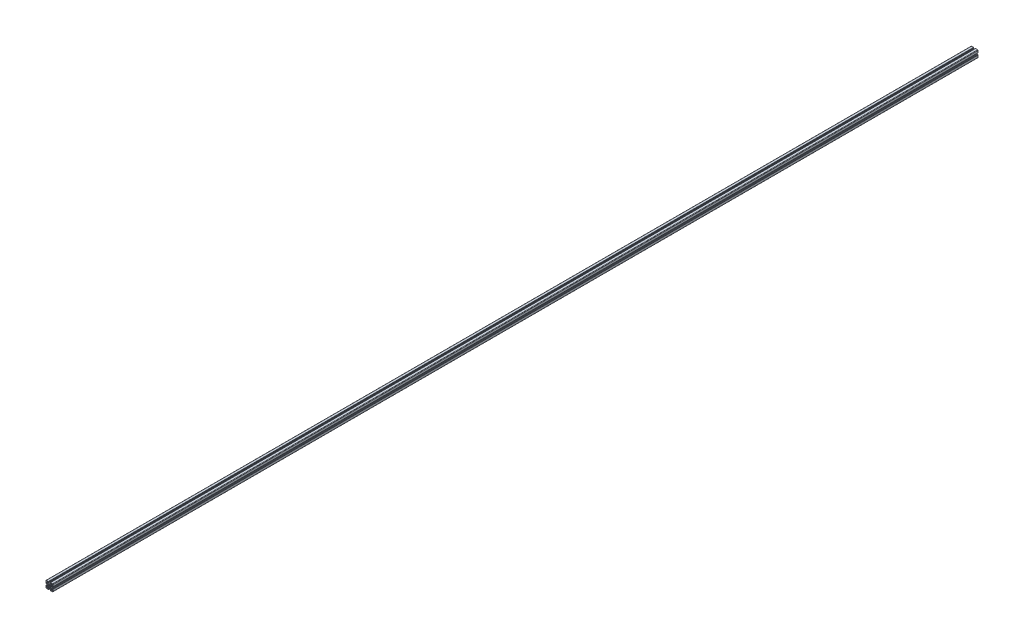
SolidWorks part; units mm, degrees
ref_plane "Front Plane" through (0, 0, 0) normal (0, 0, 1) x (1, 0, 0)
ref_plane "Top Plane" through (0, 0, 0) normal (0, 1, 0) x (1, 0, 0)
ref_plane "Right Plane" through (0, 0, 0) normal (1, 0, 0) x (0, 0, -1)
sketch "Sketch1" plane through (0, 0, 0) normal (0, 0, 1) x (1, 0, 0)
  line L0 (10.55, 18) -> (9, 18)
  line L1 (18.5, 21) -> (9, 21)
  line L2 (21, 9.0002) -> (21, 18.5)
  line L3 (18, 9.0002) -> (18, 10.55)
  line L4 (17, 11.55) -> (12.55, 11.55)
  line L5 (11.55, 12.55) -> (11.55, 17)
  line L6 (7.974, 0.7926) -> (7.5401, 0.0468)
  line L7 (-0.8674, 4.9242) -> (-0.9675, 5.4811)
  line L8 (-3.1913, 4.5626) -> (-2.864, 4.0985)
  line L9 (-4.0897, 2.8765) -> (-4.5668, 3.2082)
  line L10 (-5.4897, 0.9862) -> (-4.9205, 0.8878)
  line L11 (11.1298, 9.425) -> (7.5635, 5.8587)
  line L12 (16.3169, 9.9945) -> (12.5048, 9.9945)
  line L13 (16.5169, 5.2) -> (16.5169, 9.7945)
  line L14 (20.7196, 5) -> (16.7169, 5)
  line L15 (21.0196, 5.3) -> (21.0196, 5.5)
  line L16 (22, 5.8) -> (21.3196, 5.8)
  line L17 (22.5, 6.3) -> (22.5, 19.5)
  line L18 (19.5, 22.5) -> (6.3757, 22.5)
  line L19 (5.8757, 21.3) -> (5.8757, 22)
  line L20 (5.5757, 21) -> (5.3, 21)
  line L21 (5, 16.6668) -> (5, 20.7)
  line L22 (9.9054, 16.4668) -> (5.2, 16.4668)
  line L23 (10.1054, 12.4716) -> (10.1054, 16.2668)
  line L24 (5.9449, 7.4827) -> (9.5196, 11.0574)
  line L25 (0.1126, 7.6069) -> (0.7547, 7.9748)
  line L26 (5.4897, 0.9862) -> (4.9205, 0.8878)
  line L27 (4.0897, 2.8765) -> (4.5668, 3.2082)
  line L28 (3.1913, 4.5626) -> (2.864, 4.0985)
  line L29 (0.8674, 4.9242) -> (0.9675, 5.4811)
  line L30 (-10.55, -18) -> (-9, -18)
  line L31 (-18.5, -21) -> (-9, -21)
  line L32 (-21, -9.0002) -> (-21, -18.5)
  line L33 (-18, -9.0002) -> (-18, -10.55)
  line L34 (-17, -11.55) -> (-12.55, -11.55)
  line L35 (-11.55, -12.55) -> (-11.55, -17)
  line L36 (-7.974, -0.7926) -> (-7.5401, -0.0468)
  line L37 (-11.1298, -9.425) -> (-7.5635, -5.8587)
  line L38 (-16.3169, -9.9945) -> (-12.5048, -9.9945)
  line L39 (-16.5169, -5.2) -> (-16.5169, -9.7945)
  line L40 (-20.7196, -5) -> (-16.7169, -5)
  line L41 (-21.0196, -5.3) -> (-21.0196, -5.5)
  line L42 (-22, -5.8) -> (-21.3196, -5.8)
  line L43 (-22.5, -6.3) -> (-22.5, -19.5)
  line L44 (-19.5, -22.5) -> (-6.3757, -22.5)
  line L45 (-5.8757, -21.3) -> (-5.8757, -22)
  line L46 (-5.5757, -21) -> (-5.3, -21)
  line L47 (-5, -16.6668) -> (-5, -20.7)
  line L48 (-9.9054, -16.4668) -> (-5.2, -16.4668)
  line L49 (-10.1054, -12.4716) -> (-10.1054, -16.2668)
  line L50 (-5.9449, -7.4827) -> (-9.5196, -11.0574)
  line L51 (-0.1126, -7.6069) -> (-0.7547, -7.9748)
  line L52 (0.8674, -4.9242) -> (0.9675, -5.4811)
  line L53 (3.1913, -4.5626) -> (2.864, -4.0985)
  line L54 (4.0897, -2.8765) -> (4.5668, -3.2082)
  line L55 (5.4897, -0.9862) -> (4.9205, -0.8878)
  line L56 (0.1126, -7.6069) -> (0.7547, -7.9748)
  line L57 (5.9449, -7.4827) -> (9.5196, -11.0574)
  line L58 (10.1054, -12.4716) -> (10.1054, -16.2668)
  line L59 (9.9054, -16.4668) -> (5.2, -16.4668)
  line L60 (5, -16.6668) -> (5, -20.7)
  line L61 (5.5757, -21) -> (5.3, -21)
  line L62 (-0.1126, 7.6069) -> (-0.7547, 7.9748)
  line L63 (-5.9449, 7.4827) -> (-9.5196, 11.0574)
  line L64 (-10.1054, 12.4716) -> (-10.1054, 16.2668)
  line L65 (-9.9054, 16.4668) -> (-5.2, 16.4668)
  line L66 (-5, 16.6668) -> (-5, 20.7)
  line L67 (-5.5757, 21) -> (-5.3, 21)
  line L68 (-5.8757, 21.3) -> (-5.8757, 22)
  line L69 (-19.5, 22.5) -> (-6.3757, 22.5)
  line L70 (-22.5, 6.3) -> (-22.5, 19.5)
  line L71 (-22, 5.8) -> (-21.3196, 5.8)
  line L72 (-21.0196, 5.3) -> (-21.0196, 5.5)
  line L73 (-20.7196, 5) -> (-16.7169, 5)
  line L74 (-16.5169, 5.2) -> (-16.5169, 9.7945)
  line L75 (-16.3169, 9.9945) -> (-12.5048, 9.9945)
  line L76 (-11.1298, 9.425) -> (-7.5635, 5.8587)
  line L77 (-7.974, 0.7926) -> (-7.5401, 0.0468)
  line L78 (5.8757, -21.3) -> (5.8757, -22)
  line L79 (19.5, -22.5) -> (6.3757, -22.5)
  line L80 (22.5, -6.3) -> (22.5, -19.5)
  line L81 (22, -5.8) -> (21.3196, -5.8)
  line L82 (21.0196, -5.3) -> (21.0196, -5.5)
  line L83 (20.7196, -5) -> (16.7169, -5)
  line L84 (16.5169, -5.2) -> (16.5169, -9.7945)
  line L85 (16.3169, -9.9945) -> (12.5048, -9.9945)
  line L86 (11.1298, -9.425) -> (7.5635, -5.8587)
  line L87 (-5.4897, -0.9862) -> (-4.9205, -0.8878)
  line L88 (-4.0897, -2.8765) -> (-4.5668, -3.2082)
  line L89 (-3.1913, -4.5626) -> (-2.864, -4.0985)
  line L90 (-0.8674, -4.9242) -> (-0.9675, -5.4811)
  line L91 (7.974, -0.7926) -> (7.5401, -0.0468)
  line L92 (-11.55, 12.55) -> (-11.55, 17)
  line L93 (-17, 11.55) -> (-12.55, 11.55)
  line L94 (-18, 9.0002) -> (-18, 10.55)
  line L95 (-21, 9.0002) -> (-21, 18.5)
  line L96 (-18.5, 21) -> (-9, 21)
  line L97 (-10.55, 18) -> (-9, 18)
  line L98 (11.55, -12.55) -> (11.55, -17)
  line L99 (17, -11.55) -> (12.55, -11.55)
  line L100 (18, -9.0002) -> (18, -10.55)
  line L101 (21, -9.0002) -> (21, -18.5)
  line L102 (18.5, -21) -> (9, -21)
  line L103 (10.55, -18) -> (9, -18)
  line L104 (-33.3633, 0) -> (37.7265, 0) construction
  line L105 (0, 32.2957) -> (0, -36.0465) construction
  arc A0 (9, 18) -> (9, 21) centre (9, 19.5) cw
  arc A1 (18.5, 21) -> (21, 18.5) centre (18.5, 18.5) cw
  arc A2 (21, 9.0002) -> (18, 9.0002) centre (19.5, 9.0002) cw
  arc A3 (17, 11.55) -> (18, 10.55) centre (17, 10.55) cw
  arc A4 (12.55, 11.55) -> (11.55, 12.55) centre (12.55, 12.55) cw
  arc A5 (10.55, 18) -> (11.55, 17) centre (10.55, 17) cw
  arc A6 (7.5313, 0) -> (7.5401, 0.0468) centre (7.7309, -0.013) cw
  arc A7 (8, 0.9141) -> (7.974, 0.7926) centre (7.8011, 0.8932) cw
  arc A8 (7.2004, 3.6119) -> (8, 0.9141) centre (0.0496, 0.0249) cw
  arc A9 (7.2004, 3.6119) -> (7.5635, 5.8587) centre (8.9385, 4.4837) cw
  arc A10 (11.1298, 9.425) -> (12.5048, 9.9945) centre (12.5048, 8.05) cw
  arc A11 (16.3169, 9.9945) -> (16.5169, 9.7945) centre (16.3169, 9.7945) cw
  arc A12 (16.7169, 5) -> (16.5169, 5.2) centre (16.7169, 5.2) cw
  arc A13 (21.0196, 5.3) -> (20.7196, 5) centre (20.7196, 5.3) cw
  arc A14 (0.8674, 4.9242) -> (-0.8674, 4.9242) centre (0, 0) ccw
  arc A15 (-0.9675, 5.4811) -> (-1.5951, 5.8941) centre (-1.4627, 5.4119) ccw
  arc A16 (-1.5951, 5.8941) -> (-3.0444, 5.2994) centre (-0.0235, 0) ccw
  arc A17 (-3.0444, 5.2994) -> (-3.1913, 4.5626) centre (-2.7943, 4.8665) ccw
  arc A18 (-2.864, 4.0985) -> (-4.0897, 2.8765) centre (0, 0) ccw
  arc A19 (-4.5668, 3.2082) -> (-5.3025, 3.0565) centre (-4.868, 2.8091) ccw
  arc A20 (-5.3025, 3.0565) -> (-5.9068, 1.6112) centre (-0.0235, 0) ccw
  arc A21 (-5.9068, 1.6112) -> (-5.4897, 0.9862) centre (-5.4239, 1.4819) ccw
  arc A22 (-4.9205, 0.8878) -> (-5, 0) centre (0, 0) ccw
  arc A23 (21.0196, 5.5) -> (21.3196, 5.8) centre (21.3196, 5.5) cw
  arc A24 (22.5, 6.3) -> (22, 5.8) centre (22, 6.3) cw
  arc A25 (19.5, 22.5) -> (22.5, 19.5) centre (19.5, 19.5) cw
  arc A26 (5.8757, 22) -> (6.3757, 22.5) centre (6.3757, 22) cw
  arc A27 (5.8757, 21.3) -> (5.5757, 21) centre (5.5757, 21.3) cw
  arc A28 (5, 20.7) -> (5.3, 21) centre (5.3, 20.7) cw
  arc A29 (5.2, 16.4668) -> (5, 16.6668) centre (5.2, 16.6668) cw
  arc A30 (9.9054, 16.4668) -> (10.1054, 16.2668) centre (9.9054, 16.2668) cw
  arc A31 (10.1054, 12.4716) -> (9.5196, 11.0574) centre (8.1054, 12.4716) cw
  arc A32 (5.9449, 7.4827) -> (3.6665, 7.1733) centre (4.5855, 8.9496) cw
  arc A33 (0.8764, 8) -> (3.6665, 7.1733) centre (0.0235, 0) cw
  arc A34 (0.7547, 7.9748) -> (0.8764, 8) centre (0.8542, 7.8013) cw
  arc A35 (0.1126, 7.6069) -> (0, 7.531) centre (-0.0489, 7.7249) cw
  arc A36 (4.9205, 0.8878) -> (5, 0) centre (0, 0) cw
  arc A37 (5.9068, 1.6112) -> (5.4897, 0.9862) centre (5.4239, 1.4819) cw
  arc A38 (5.3025, 3.0565) -> (5.9068, 1.6112) centre (0.0235, 0) cw
  arc A39 (4.5668, 3.2082) -> (5.3025, 3.0565) centre (4.868, 2.8091) cw
  arc A40 (2.864, 4.0985) -> (4.0897, 2.8765) centre (0, 0) cw
  arc A41 (3.0444, 5.2994) -> (3.1913, 4.5626) centre (2.7943, 4.8665) cw
  arc A42 (1.5951, 5.8941) -> (3.0444, 5.2994) centre (0.0235, 0) cw
  arc A43 (0.9675, 5.4811) -> (1.5951, 5.8941) centre (1.4627, 5.4119) cw
  arc A44 (-9, -18) -> (-9, -21) centre (-9, -19.5) cw
  arc A45 (-18.5, -21) -> (-21, -18.5) centre (-18.5, -18.5) cw
  arc A46 (-21, -9.0002) -> (-18, -9.0002) centre (-19.5, -9.0002) cw
  arc A47 (-17, -11.55) -> (-18, -10.55) centre (-17, -10.55) cw
  arc A48 (-12.55, -11.55) -> (-11.55, -12.55) centre (-12.55, -12.55) cw
  arc A49 (-10.55, -18) -> (-11.55, -17) centre (-10.55, -17) cw
  arc A50 (-7.5313, 0) -> (-7.5401, -0.0468) centre (-7.7309, 0.013) cw
  arc A51 (-8, -0.9141) -> (-7.974, -0.7926) centre (-7.8011, -0.8932) cw
  arc A52 (-7.2004, -3.6119) -> (-8, -0.9141) centre (-0.0496, -0.0249) cw
  arc A53 (-7.2004, -3.6119) -> (-7.5635, -5.8587) centre (-8.9385, -4.4837) cw
  arc A54 (-11.1298, -9.425) -> (-12.5048, -9.9945) centre (-12.5048, -8.05) cw
  arc A55 (-16.3169, -9.9945) -> (-16.5169, -9.7945) centre (-16.3169, -9.7945) cw
  arc A56 (-16.7169, -5) -> (-16.5169, -5.2) centre (-16.7169, -5.2) cw
  arc A57 (-21.0196, -5.3) -> (-20.7196, -5) centre (-20.7196, -5.3) cw
  arc A58 (-21.0196, -5.5) -> (-21.3196, -5.8) centre (-21.3196, -5.5) cw
  arc A59 (-22.5, -6.3) -> (-22, -5.8) centre (-22, -6.3) cw
  arc A60 (-19.5, -22.5) -> (-22.5, -19.5) centre (-19.5, -19.5) cw
  arc A61 (-5.8757, -22) -> (-6.3757, -22.5) centre (-6.3757, -22) cw
  arc A62 (-5.8757, -21.3) -> (-5.5757, -21) centre (-5.5757, -21.3) cw
  arc A63 (-5, -20.7) -> (-5.3, -21) centre (-5.3, -20.7) cw
  arc A64 (-5.2, -16.4668) -> (-5, -16.6668) centre (-5.2, -16.6668) cw
  arc A65 (-9.9054, -16.4668) -> (-10.1054, -16.2668) centre (-9.9054, -16.2668) cw
  arc A66 (-10.1054, -12.4716) -> (-9.5196, -11.0574) centre (-8.1054, -12.4716) cw
  arc A67 (-5.9449, -7.4827) -> (-3.6665, -7.1733) centre (-4.5855, -8.9496) cw
  arc A68 (-0.8764, -8) -> (-3.6665, -7.1733) centre (-0.0235, 0) cw
  arc A69 (-0.7547, -7.9748) -> (-0.8764, -8) centre (-0.8542, -7.8013) cw
  arc A70 (-0.1126, -7.6069) -> (0, -7.531) centre (0.0489, -7.7249) cw
  arc A71 (0.9675, -5.4811) -> (1.5951, -5.8941) centre (1.4627, -5.4119) ccw
  arc A72 (1.5951, -5.8941) -> (3.0444, -5.2994) centre (0.0235, 0) ccw
  arc A73 (3.0444, -5.2994) -> (3.1913, -4.5626) centre (2.7943, -4.8665) ccw
  arc A74 (2.864, -4.0985) -> (4.0897, -2.8765) centre (0, 0) ccw
  arc A75 (4.5668, -3.2082) -> (5.3025, -3.0565) centre (4.868, -2.8091) ccw
  arc A76 (5.3025, -3.0565) -> (5.9068, -1.6112) centre (0.0235, 0) ccw
  arc A77 (5.9068, -1.6112) -> (5.4897, -0.9862) centre (5.4239, -1.4819) ccw
  arc A78 (4.9205, -0.8878) -> (5, 0) centre (0, 0) ccw
  arc A79 (0.1126, -7.6069) -> (0, -7.531) centre (-0.0489, -7.7249) ccw
  arc A80 (0.7547, -7.9748) -> (0.8764, -8) centre (0.8542, -7.8013) ccw
  arc A81 (0.8764, -8) -> (3.6665, -7.1733) centre (0.0235, 0) ccw
  arc A82 (5.9449, -7.4827) -> (3.6665, -7.1733) centre (4.5855, -8.9496) ccw
  arc A83 (10.1054, -12.4716) -> (9.5196, -11.0574) centre (8.1054, -12.4716) ccw
  arc A84 (9.9054, -16.4668) -> (10.1054, -16.2668) centre (9.9054, -16.2668) ccw
  arc A85 (5.2, -16.4668) -> (5, -16.6668) centre (5.2, -16.6668) ccw
  arc A86 (5, -20.7) -> (5.3, -21) centre (5.3, -20.7) ccw
  arc A87 (5.8757, -21.3) -> (5.5757, -21) centre (5.5757, -21.3) ccw
  arc A88 (-0.1126, 7.6069) -> (0, 7.531) centre (0.0489, 7.7249) ccw
  arc A89 (-0.7547, 7.9748) -> (-0.8764, 8) centre (-0.8542, 7.8013) ccw
  arc A90 (-0.8764, 8) -> (-3.6665, 7.1733) centre (-0.0235, 0) ccw
  arc A91 (-5.9449, 7.4827) -> (-3.6665, 7.1733) centre (-4.5855, 8.9496) ccw
  arc A92 (-10.1054, 12.4716) -> (-9.5196, 11.0574) centre (-8.1054, 12.4716) ccw
  arc A93 (-9.9054, 16.4668) -> (-10.1054, 16.2668) centre (-9.9054, 16.2668) ccw
  arc A94 (-5.2, 16.4668) -> (-5, 16.6668) centre (-5.2, 16.6668) ccw
  arc A95 (-5, 20.7) -> (-5.3, 21) centre (-5.3, 20.7) ccw
  arc A96 (-5.8757, 21.3) -> (-5.5757, 21) centre (-5.5757, 21.3) ccw
  arc A97 (-5.8757, 22) -> (-6.3757, 22.5) centre (-6.3757, 22) ccw
  arc A98 (-19.5, 22.5) -> (-22.5, 19.5) centre (-19.5, 19.5) ccw
  arc A99 (-22.5, 6.3) -> (-22, 5.8) centre (-22, 6.3) ccw
  arc A100 (-21.0196, 5.5) -> (-21.3196, 5.8) centre (-21.3196, 5.5) ccw
  arc A101 (-21.0196, 5.3) -> (-20.7196, 5) centre (-20.7196, 5.3) ccw
  arc A102 (-16.7169, 5) -> (-16.5169, 5.2) centre (-16.7169, 5.2) ccw
  arc A103 (-16.3169, 9.9945) -> (-16.5169, 9.7945) centre (-16.3169, 9.7945) ccw
  arc A104 (-11.1298, 9.425) -> (-12.5048, 9.9945) centre (-12.5048, 8.05) ccw
  arc A105 (-7.2004, 3.6119) -> (-7.5635, 5.8587) centre (-8.9385, 4.4837) ccw
  arc A106 (-7.2004, 3.6119) -> (-8, 0.9141) centre (-0.0496, 0.0249) ccw
  arc A107 (-8, 0.9141) -> (-7.974, 0.7926) centre (-7.8011, 0.8932) ccw
  arc A108 (-7.5313, 0) -> (-7.5401, 0.0468) centre (-7.7309, -0.013) ccw
  arc A109 (5.8757, -22) -> (6.3757, -22.5) centre (6.3757, -22) ccw
  arc A110 (19.5, -22.5) -> (22.5, -19.5) centre (19.5, -19.5) ccw
  arc A111 (22.5, -6.3) -> (22, -5.8) centre (22, -6.3) ccw
  arc A112 (21.0196, -5.5) -> (21.3196, -5.8) centre (21.3196, -5.5) ccw
  arc A113 (-4.9205, -0.8878) -> (-5, 0) centre (0, 0) cw
  arc A114 (-5.9068, -1.6112) -> (-5.4897, -0.9862) centre (-5.4239, -1.4819) cw
  arc A115 (-5.3025, -3.0565) -> (-5.9068, -1.6112) centre (-0.0235, 0) cw
  arc A116 (-4.5668, -3.2082) -> (-5.3025, -3.0565) centre (-4.868, -2.8091) cw
  arc A117 (-2.864, -4.0985) -> (-4.0897, -2.8765) centre (0, 0) cw
  arc A118 (-3.0444, -5.2994) -> (-3.1913, -4.5626) centre (-2.7943, -4.8665) cw
  arc A119 (-1.5951, -5.8941) -> (-3.0444, -5.2994) centre (-0.0235, 0) cw
  arc A120 (-0.9675, -5.4811) -> (-1.5951, -5.8941) centre (-1.4627, -5.4119) cw
  arc A121 (0.8674, -4.9242) -> (-0.8674, -4.9242) centre (0, 0) cw
  arc A122 (21.0196, -5.3) -> (20.7196, -5) centre (20.7196, -5.3) ccw
  arc A123 (16.7169, -5) -> (16.5169, -5.2) centre (16.7169, -5.2) ccw
  arc A124 (-10.55, 18) -> (-11.55, 17) centre (-10.55, 17) ccw
  arc A125 (-12.55, 11.55) -> (-11.55, 12.55) centre (-12.55, 12.55) ccw
  arc A126 (-17, 11.55) -> (-18, 10.55) centre (-17, 10.55) ccw
  arc A127 (-21, 9.0002) -> (-18, 9.0002) centre (-19.5, 9.0002) ccw
  arc A128 (-18.5, 21) -> (-21, 18.5) centre (-18.5, 18.5) ccw
  arc A129 (-9, 18) -> (-9, 21) centre (-9, 19.5) ccw
  arc A130 (16.3169, -9.9945) -> (16.5169, -9.7945) centre (16.3169, -9.7945) ccw
  arc A131 (11.1298, -9.425) -> (12.5048, -9.9945) centre (12.5048, -8.05) ccw
  arc A132 (7.2004, -3.6119) -> (7.5635, -5.8587) centre (8.9385, -4.4837) ccw
  arc A133 (7.2004, -3.6119) -> (8, -0.9141) centre (0.0496, -0.0249) ccw
  arc A134 (8, -0.9141) -> (7.974, -0.7926) centre (7.8011, -0.8932) ccw
  arc A135 (7.5313, 0) -> (7.5401, -0.0468) centre (7.7309, 0.013) ccw
  arc A136 (10.55, -18) -> (11.55, -17) centre (10.55, -17) ccw
  arc A137 (12.55, -11.55) -> (11.55, -12.55) centre (12.55, -12.55) ccw
  arc A138 (17, -11.55) -> (18, -10.55) centre (17, -10.55) ccw
  arc A139 (21, -9.0002) -> (18, -9.0002) centre (19.5, -9.0002) ccw
  arc A140 (18.5, -21) -> (21, -18.5) centre (18.5, -18.5) ccw
  arc A141 (9, -18) -> (9, -21) centre (9, -19.5) ccw
  dimension "D6" = 12.2
  dimension "D8" = 10
  dimension "D1" = 10
  dimension "D2" = 45
  dimension "D3" = 45
  dimension "D4" = 10
  dimension "D5" = 14.5
  dimension "D7" = 22.5
extrude "Base-Extrude" add sketch "Sketch1" against normal blind 6000
